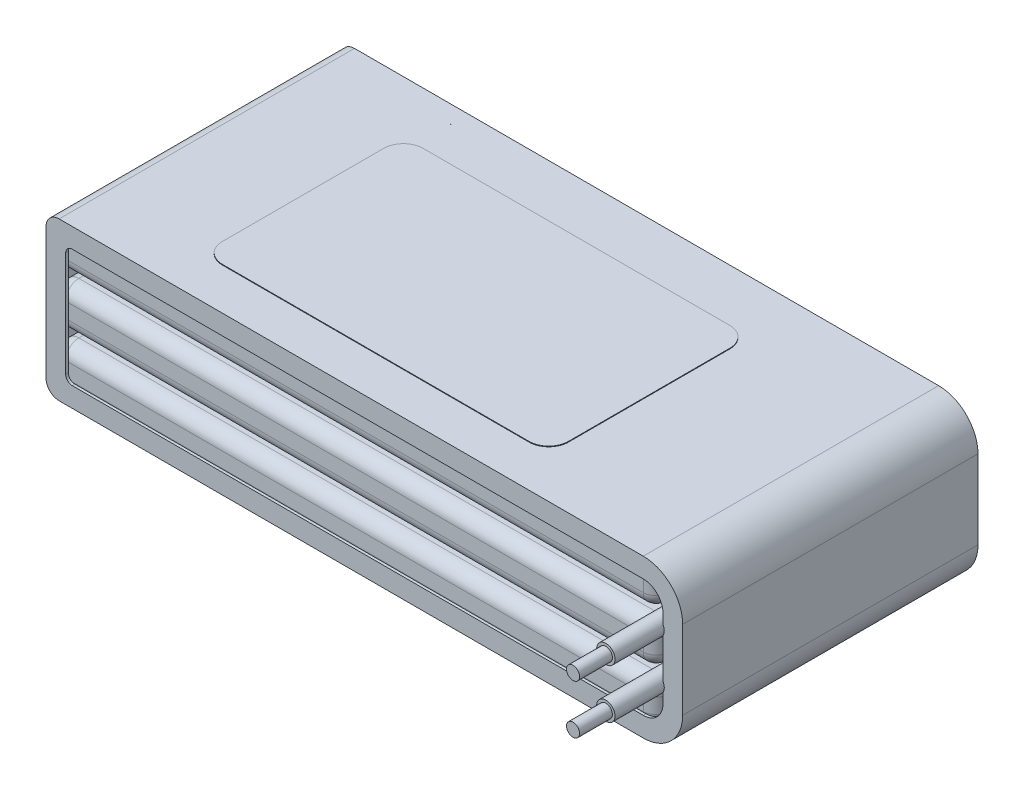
SolidWorks part; units mm, degrees
ref_plane "Front Plane" through (0, 0, 0) normal (0, 0, 1) x (1, 0, 0)
ref_plane "Top Plane" through (0, 0, 0) normal (0, 1, 0) x (1, 0, 0)
ref_plane "Right Plane" through (0, 0, 0) normal (1, 0, 0) x (0, 0, -1)
sketch "Sketch1" plane through (0, 0, 0) normal (0, 1, 0) x (1, 0, 0)
  line L1 (46, 22) -> (-46, 22)
  line L2 (46, 22) -> (46, -22)
  line L3 (46, -22) -> (-46, -22)
  line L4 (-46, 22) -> (-46, -22)
  line L5 (46, 22) -> (-46, -22) construction
  line L6 (46, -22) -> (-46, 22) construction
  point P0 (0, 0)
  dimension "D1" = 44
  dimension "D2" = 92
extrude "Boss-Extrude1" add sketch "Sketch1" along normal mid plane 6.3
fillet "Fillet1" radius 2 12 edges at (0, -3.15, -22) (46, -3.15, 0) (0, -3.15, 22) (-46, -3.15, 0) (0, 3.15, 22) (46, 3.15, 0) (0, 3.15, -22) (-46, 3.15, 0) (46, 0, -22) (-46, 0, -22) (-46, 0, 22) (46, 0, 22)
pattern_linear "LPattern2" count 3 spacing 7.85 along (0, -1, 0)
sketch "Sketch3" plane through (0, 0, 0) normal (0, 0, 1) x (1, 0, 0)
  line L0 (-46.5, 2.15) -> (-46.5, -17.85)
  line L1 (67.3197, -7.85) -> (-71.2993, -7.85) construction
  line L2 (-44, -4.7) -> (44, -4.7) construction
  line L3 (44, -11) -> (-44, -11) construction
  line L4 (-44.5, 4.15) -> (44.5, 4.15)
  line L5 (-44.5, -19.85) -> (44.5, -19.85)
  line L6 (50.5, -1.85) -> (50.5, -13.85)
  line L7 (-46, -9) -> (-46, -6.7) construction
  line L8 (-44.5, 3.65) -> (44.5, 3.65)
  line L9 (50, -1.85) -> (50, -13.85)
  line L10 (-44.5, -19.35) -> (44.5, -19.35)
  line L11 (-46, 2.15) -> (-46, -17.85)
  arc A0 (-46.5, -17.85) -> (-44.5, -19.85) centre (-44.5, -17.85) ccw
  arc A1 (-46.5, 2.15) -> (-44.5, 4.15) centre (-44.5, 2.15) cw
  arc A2 (44.5, -19.85) -> (50.5, -13.85) centre (44.5, -13.85) ccw
  arc A3 (44.5, 4.15) -> (50.5, -1.85) centre (44.5, -1.85) cw
  arc A4 (44.5, 3.65) -> (50, -1.85) centre (44.5, -1.85) cw
  arc A5 (44.5, -19.35) -> (50, -13.85) centre (44.5, -13.85) ccw
  arc A6 (-46, -17.85) -> (-44.5, -19.35) centre (-44.5, -17.85) ccw
  arc A7 (-46, 2.15) -> (-44.5, 3.65) centre (-44.5, 2.15) cw
  point P14 (-46.5, -19.85)
  point P17 (-46.5, 4.15)
  point P22 (50.5, 4.15)
  dimension "D4" = 2
  dimension "D5" = 6
  dimension "D1" = 24
  dimension "D2" = 97
  dimension "D3" = 0.5
  dimension "D6" = 0.5
extrude "Boss-Extrude2" add sketch "Sketch3" along normal mid plane 45 separate body
sketch "Sketch6" plane through (0, 0, -22.5) normal (0, 0, -1) x (-1, 0, 0)
  line L0 (-44.5, 4.15) -> (44.5, 4.15) construction
  line L1 (-50.5, -13.85) -> (-50.5, -1.85) construction
  line L2 (44.5, -19.85) -> (-44.5, -19.85) construction
  line L3 (46.5, 2.15) -> (46.5, -17.85) construction
  line L4 (-44.5, 4.15) -> (44.5, 4.15)
  line L5 (-50.5, -13.85) -> (-50.5, -1.85)
  line L6 (44.5, -19.85) -> (-44.5, -19.85)
  line L7 (46.5, 2.15) -> (46.5, -17.85)
  line L8 (43.5, -16.85) -> (-44.5, -16.85)
  line L9 (-47.5, -13.85) -> (-47.5, -1.85)
  line L10 (-44.5, 1.15) -> (43.5, 1.15)
  line L11 (43.5, 1.15) -> (43.5, -16.85)
  arc A0 (-44.5, 4.15) -> (-50.5, -1.85) centre (-44.5, -1.85) ccw construction
  arc A1 (-50.5, -13.85) -> (-44.5, -19.85) centre (-44.5, -13.85) ccw construction
  arc A2 (44.5, -19.85) -> (46.5, -17.85) centre (44.5, -17.85) ccw construction
  arc A3 (46.5, 2.15) -> (44.5, 4.15) centre (44.5, 2.15) ccw construction
  arc A4 (-44.5, 4.15) -> (-50.5, -1.85) centre (-44.5, -1.85) ccw
  arc A5 (-50.5, -13.85) -> (-44.5, -19.85) centre (-44.5, -13.85) ccw
  arc A6 (44.5, -19.85) -> (46.5, -17.85) centre (44.5, -17.85) ccw
  arc A7 (46.5, 2.15) -> (44.5, 4.15) centre (44.5, 2.15) ccw
  arc A8 (-47.5, -13.85) -> (-44.5, -16.85) centre (-44.5, -13.85) ccw
  arc A9 (-44.5, 1.15) -> (-47.5, -1.85) centre (-44.5, -1.85) ccw
  arc A10 (43.5, 1.15) -> (43.5, 1.15) centre (43.5, 1.15) ccw
  arc A11 (43.5, -16.85) -> (43.5, -16.85) centre (43.5, -16.85) ccw
  dimension "D1" = 3
extrude "Boss-Extrude5" add sketch "Sketch6" against normal blind 0.4
sketch "Sketch7" plane through (0, 0, 22.5) normal (0, 0, 1) x (1, 0, 0)
  line L0 (44.5, 4.15) -> (-44.5, 4.15) construction
  line L1 (50.5, -13.85) -> (50.5, -1.85) construction
  line L2 (-44.5, -19.85) -> (44.5, -19.85) construction
  line L3 (-46.5, 2.15) -> (-46.5, -17.85) construction
  line L4 (44.5, 4.15) -> (-44.5, 4.15)
  line L5 (50.5, -13.85) -> (50.5, -1.85)
  line L6 (-44.5, -19.85) -> (44.5, -19.85)
  line L7 (-46.5, 2.15) -> (-46.5, -17.85)
  line L8 (44.5, 1.15) -> (-43.5, 1.15)
  line L9 (-43.5, 1.15) -> (-43.5, -16.85)
  line L10 (-43.5, -16.85) -> (44.5, -16.85)
  line L11 (47.5, -13.85) -> (47.5, -1.85)
  arc A0 (50.5, -1.85) -> (44.5, 4.15) centre (44.5, -1.85) ccw construction
  arc A1 (44.5, -19.85) -> (50.5, -13.85) centre (44.5, -13.85) ccw construction
  arc A2 (-46.5, -17.85) -> (-44.5, -19.85) centre (-44.5, -17.85) ccw construction
  arc A3 (-44.5, 4.15) -> (-46.5, 2.15) centre (-44.5, 2.15) ccw construction
  arc A4 (50.5, -1.85) -> (44.5, 4.15) centre (44.5, -1.85) ccw
  arc A5 (44.5, -19.85) -> (50.5, -13.85) centre (44.5, -13.85) ccw
  arc A6 (-46.5, -17.85) -> (-44.5, -19.85) centre (-44.5, -17.85) ccw
  arc A7 (-44.5, 4.15) -> (-46.5, 2.15) centre (-44.5, 2.15) ccw
  arc A8 (-43.5, 1.15) -> (-43.5, 1.15) centre (-43.5, 1.15) ccw
  arc A9 (-43.5, -16.85) -> (-43.5, -16.85) centre (-43.5, -16.85) ccw
  arc A10 (44.5, -16.85) -> (47.5, -13.85) centre (44.5, -13.85) ccw
  arc A11 (47.5, -1.85) -> (44.5, 1.15) centre (44.5, -1.85) ccw
  dimension "D1" = 3
extrude "Boss-Extrude7" add sketch "Sketch7" against normal blind 0.4
fillet "Fillet2" radius 1 4 edges at (-43.5, -16.85, -22.3) (-43.5, 1.15, -22.3) (-43.5, 1.15, 22.3) (-43.5, -16.85, 22.3)
sketch "Sketch4" plane through (0, 0, 0) normal (0, 0, 1) x (1, 0, 0)
  line L0 (46.3, -31.3543) -> (46.3, 14.3954) construction
  line L1 (50.5, -13.85) -> (50.5, -1.85) construction
  line L2 (-52.7508, -7.85) -> (63.1947, -7.85) construction
  line L3 (44, -6.7) -> (-44, -6.7) construction
  line L4 (-44, -9) -> (44, -9) construction
  circle A0 centre (46.3, -4.1) radius 1.4
  circle A1 centre (46.3, -11.6) radius 1.4
  dimension "D2" = 2.8
  dimension "D1" = 4.2
  dimension "D3" = 7.5
extrude "Boss-Extrude8" add sketch "Sketch4" along normal blind 30 separate body
sketch "Sketch5" plane through (0, 0, 30) normal (0, 0, 1) x (1, 0, 0)
  circle A0 centre (46.3, -4.1) radius 1
  circle A1 centre (46.3, -11.6) radius 1
  circle A2 centre (46.3, -4.1) radius 1.4 construction
  circle A3 centre (46.3, -11.6) radius 1.4 construction
  dimension "D1" = 2
extrude "Boss-Extrude4" add sketch "Sketch5" along normal blind 5 separate body
sketch "Sketch8" plane through (0, 4.15, 0) normal (0, 1, 0) x (1, 0, 0)
  line L1 (-25.983, 14.4377) -> (20.7561, 14.4377)
  line L2 (-28.983, 11.4377) -> (-28.983, -13.1568)
  line L3 (-25.983, -16.1568) -> (20.7561, -16.1568)
  line L4 (23.7561, 11.4377) -> (23.7561, -13.1568)
  line L5 (-28.983, 14.4377) -> (23.7561, -16.1568) construction
  line L6 (-28.983, -16.1568) -> (23.7561, 14.4377) construction
  arc A0 (-28.983, -13.1568) -> (-25.983, -16.1568) centre (-25.983, -13.1568) ccw
  arc A1 (20.7561, -16.1568) -> (23.7561, -13.1568) centre (20.7561, -13.1568) ccw
  arc A2 (20.7561, 14.4377) -> (23.7561, 11.4377) centre (20.7561, 11.4377) cw
  arc A3 (-25.983, 14.4377) -> (-28.983, 11.4377) centre (-25.983, 11.4377) ccw
  point P0 (-2.6135, -0.8595)
  dimension "D1" = 3
extrude "Boss-Extrude9" add sketch "Sketch8" along normal blind 0.1 separate body
